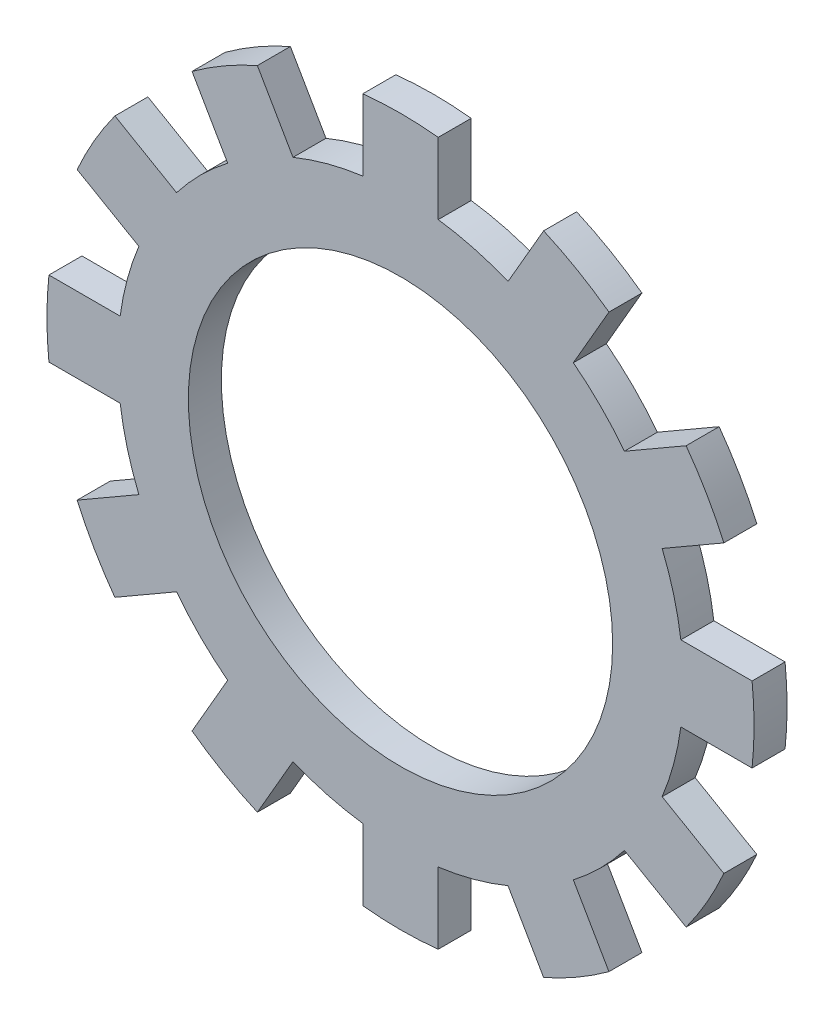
SolidWorks part; units mm, degrees
ref_plane "Front Plane" through (0, 0, 0) normal (0, 0, 1) x (1, 0, 0)
ref_plane "Top Plane" through (0, 0, 0) normal (0, 1, 0) x (1, 0, 0)
ref_plane "Right Plane" through (0, 0, 0) normal (1, 0, 0) x (0, 0, -1)
sketch "Sketch1" plane through (0, 0, 0) normal (0, 0, 1) x (1, 0, 0)
  circle A0 centre (0, 0) radius 9
  circle A1 centre (0, 0) radius 12
  dimension "D1" = 18
  dimension "D2" = 24
extrude "Boss-Extrude1" add sketch "Sketch1" along normal mid plane 1.4
sketch "Sketch2" plane through (0, 0, 0) normal (0, 0, 1) x (1, 0, 0)
  line L0 (0, 2.6811) -> (0, -2.8425) construction
sketch "Sketch3" plane through (0, 0, 0) normal (0, 0, 1) x (1, 0, 0)
  line L0 (-1.6, 14.9144) -> (-1.6, 11.8929)
  line L2 (0, 2.6811) -> (0, -2.8425) construction
  line L3 (0, 12) -> (0, 15)
  arc A0 (0, 15) -> (-1.6, 14.9144) centre (0, 0) ccw
  arc A1 (0, 12) -> (-1.6, 11.8929) centre (0, 0) ccw
  circle A2 centre (0, 0) radius 12 construction
  dimension "D2" = 15
  dimension "D1" = 1.6
extrude "Boss-Extrude2" add sketch "Sketch3" along normal mid plane 1.4
mirror "Mirror1" about plane through (0, 0, 0) normal (1, 0, 0) of "Boss-Extrude2"
pattern_circular "CirPattern2" count 12 over 360 about axis through (0, 0, 0) along (0, 0, 1) of "Boss-Extrude2", "Mirror1"
